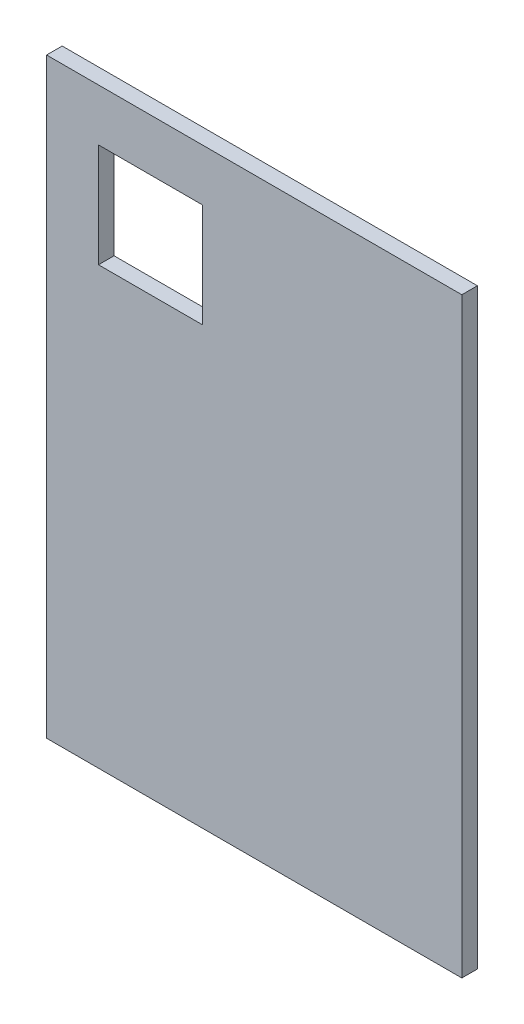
SolidWorks part; units mm, degrees
ref_plane "Alzado" through (0, 0, 0) normal (0, 0, 1) x (1, 0, 0)
ref_plane "Planta" through (0, 0, 0) normal (0, 1, 0) x (1, 0, 0)
ref_plane "Vista lateral" through (0, 0, 0) normal (1, 0, 0) x (0, 0, -1)
sketch "Croquis1" plane through (0, 0, 0) normal (0, 0, 1) x (1, 0, 0)
  line L1 (-200, 285) -> (200, 285)
  line L2 (-200, 285) -> (-200, -285)
  line L3 (-200, -285) -> (200, -285)
  line L4 (200, 285) -> (200, -285)
  line L5 (-200, 285) -> (200, -285) construction
  line L6 (-200, -285) -> (200, 285) construction
  point P0 (0, 0)
  dimension "D1" = 400
  dimension "D2" = 570
extrude "Saliente-Extruir1" add sketch "Croquis1" along normal blind 15
sketch "Croquis2" plane through (0, 0, 15) normal (0, 0, 1) x (1, 0, 0)
  line L0 (200, 285) -> (-200, 285) construction
  line L1 (-150, 235) -> (-50, 235)
  line L2 (-150, 235) -> (-150, 135)
  line L3 (-150, 135) -> (-50, 135)
  line L4 (-50, 235) -> (-50, 135)
  line L5 (-150, 235) -> (-50, 135) construction
  line L6 (-150, 135) -> (-50, 235) construction
  line L7 (-200, 285) -> (-200, -285) construction
  point P0 (-100, 185)
  point P5 (-100, 185)
  dimension "D1" = 100
  dimension "D2" = 100
  dimension "D3" = 100
  dimension "D4" = 100
extrude "Cortar-Extruir1" cut sketch "Croquis2" against normal blind 15
